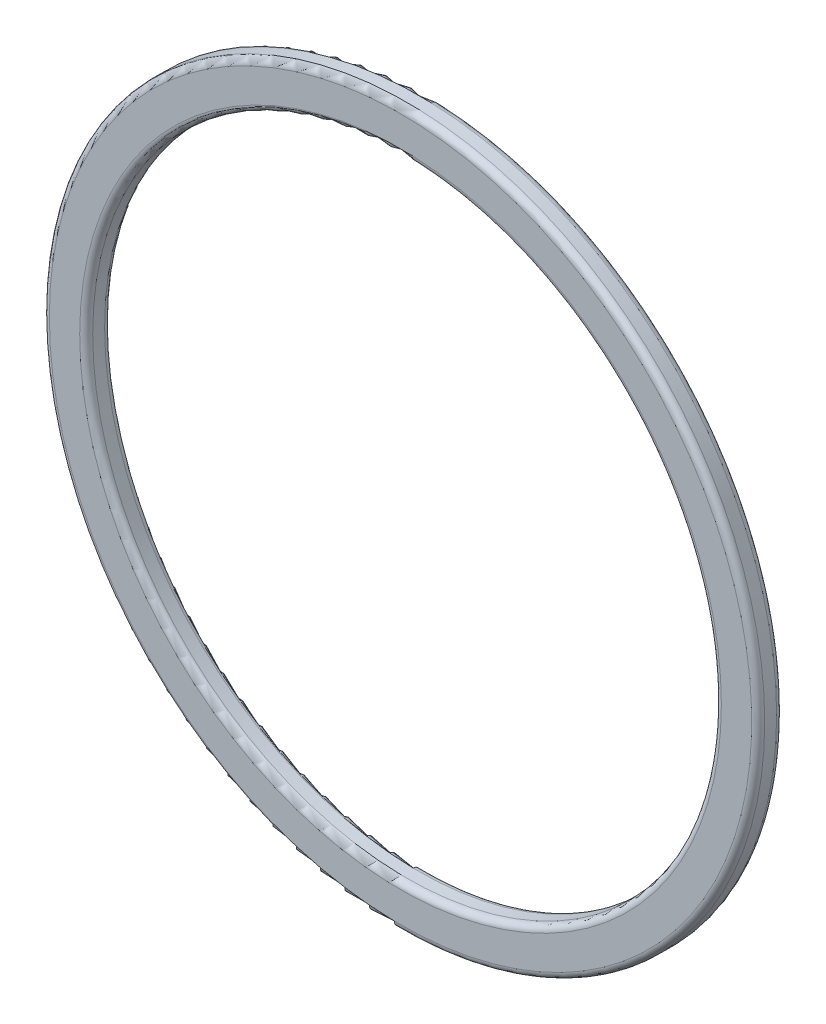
SolidWorks part; units mm, degrees
ref_plane "Plan de face" through (0, 0, 0) normal (0, 0, 1) x (1, 0, 0)
ref_plane "Plan de dessus" through (0, 0, 0) normal (0, 1, 0) x (1, 0, 0)
ref_plane "Plan de droite" through (0, 0, 0) normal (1, 0, 0) x (0, 0, -1)
sketch "Esquisse1" plane through (0, 0, 0) normal (0, 0, 1) x (1, 0, 0)
  circle A0 centre (0, 0) radius 29
  dimension "D1" = 58
sketch "Esquisse2" plane through (0, 0, 0) normal (0, 1, 0) x (1, 0, 0)
  line L1 (-32.4, 1.0131) -> (-29.6, 1.0131)
  line L2 (-33, 0.4131) -> (-33, -0.6869)
  line L3 (-32.4, -1.2869) -> (-29.6, -1.2869)
  line L4 (-29, 0.4131) -> (-29, -0.6869)
  arc A0 (-29.6, 1.0131) -> (-29, 0.4131) centre (-29.6, 0.4131) cw
  arc A1 (-29, -0.6869) -> (-29.6, -1.2869) centre (-29.6, -0.6869) cw
  arc A2 (-32.4, -1.2869) -> (-33, -0.6869) centre (-32.4, -0.6869) cw
  arc A3 (-33, 0.4131) -> (-32.4, 1.0131) centre (-32.4, 0.4131) cw
  dimension "D4" = 0.6
  dimension "D1" = 2.3
  dimension "D2" = 29
  dimension "D3" = 33
sweep "Balayage1" add profiles "Esquisse2" path "Esquisse1"
